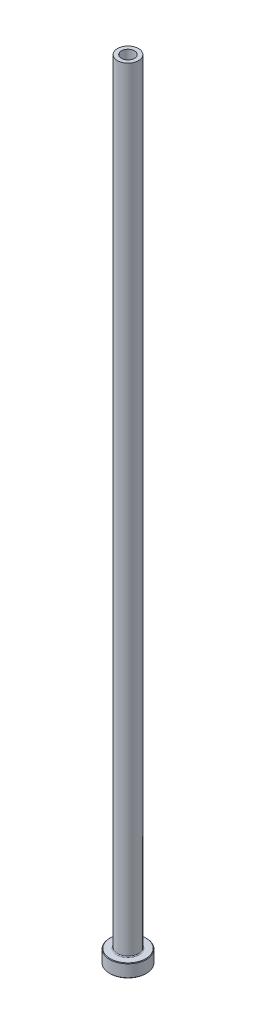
SolidWorks part; units mm, degrees
ref_plane "Front Plane" through (0, 0, 0) normal (0, 0, 1) x (1, 0, 0)
ref_plane "Top Plane" through (0, 0, 0) normal (0, 1, 0) x (1, 0, 0)
ref_plane "Right Plane" through (0, 0, 0) normal (1, 0, 0) x (0, 0, -1)
sketch "Sketch1" plane through (0, 0, 0) normal (0, 0, 1) x (1, 0, 0)
  line L0 (-2.5, 300) -> (-4, 300)
  line L1 (-4, 300) -> (-4, 5)
  line L2 (-4, 5) -> (-7, 5)
  line L3 (-7, 5) -> (-7, 0)
  line L4 (7.7, 0) -> (-7.7, 0) construction
  line L5 (-7, 0) -> (-2.75, 0)
  line L6 (-2.5, 255) -> (-2.5, 300)
  line L7 (0, 92.1877) -> (0, -15.5353) construction
  line L8 (0, -7.7) -> (0, 7.7) construction
  line L9 (-2.5, 255) -> (-2.75, 243)
  line L10 (-2.75, 243) -> (-2.75, 0)
  dimension "D1" = 0.25
  dimension "ID" = 5
  dimension "OD" = 8
  dimension "L" = 300
  dimension "H" = 14
  dimension "T" = 5
  dimension "N" = 45
  dimension "D2" = 12
revolve "Revolve1" add sketch "Sketch1" angle 360 about L7
fillet "Fillet1" radius 0.3 1 edges at (0, 5, 4)
chamfer "Chamfer1" distance 0.2 angle 45 2 edges at (0, 5, 7) (0, 0, 7)
chamfer "Chamfer3" distance 0.5 angle 45 1 edges at (0, 0, 2.75)
